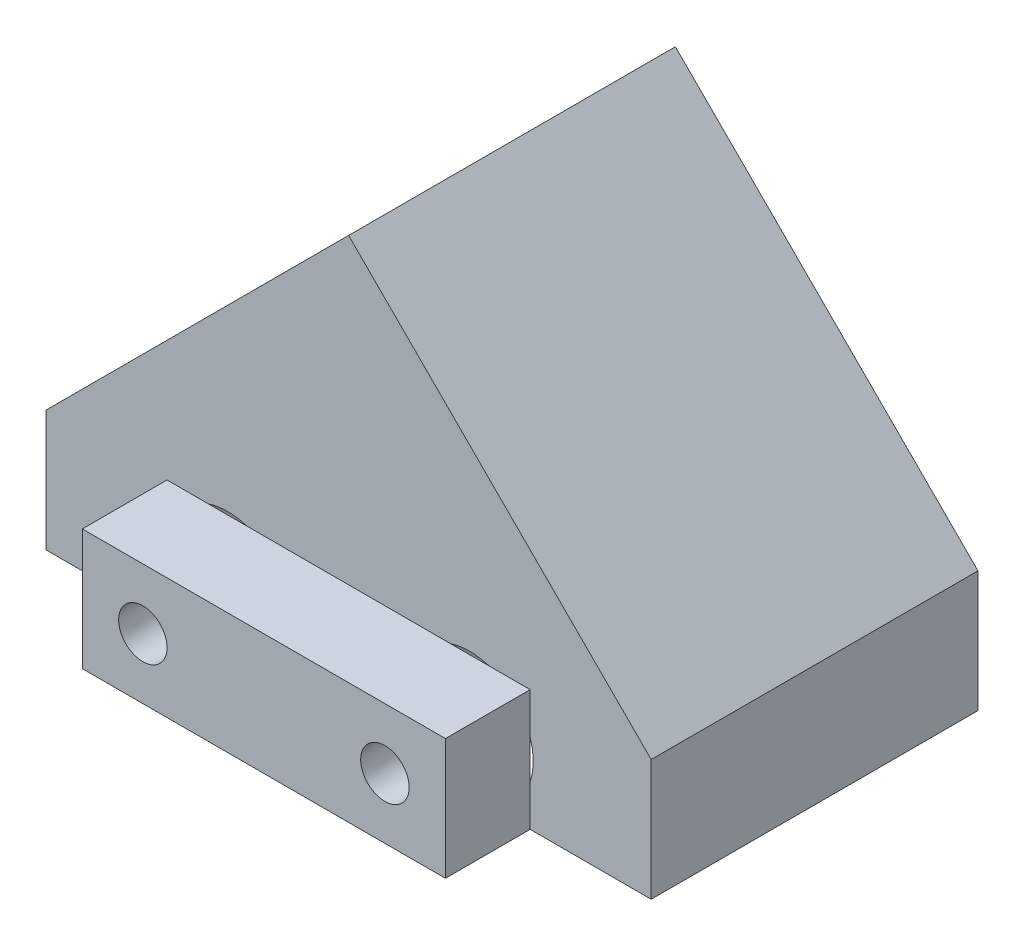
SolidWorks part; units mm, degrees
ref_plane "Plan de face" through (0, 0, 0) normal (0, 0, 1) x (1, 0, 0)
ref_plane "Plan de dessus" through (0, 0, 0) normal (0, 1, 0) x (1, 0, 0)
ref_plane "Plan de droite" through (0, 0, 0) normal (1, 0, 0) x (0, 0, -1)
sketch "Esquisse1" plane through (0, 0, 0) normal (0, 0, 1) x (1, 0, 0)
  line L1 (0, 0) -> (50, 0)
  line L2 (0, 0) -> (0, 35)
  line L3 (0, 35) -> (50, 35)
  line L4 (50, 0) -> (50, 35)
  point P7 (0, 0)
  dimension "D1" = 50
  dimension "D2" = 35
extrude "Boss.-Extru.1" add sketch "Esquisse1" along normal blind 27
sketch "Esquisse2" plane through (0, 0, 0) normal (0, 0, -1) x (-1, 0, 0)
  line L0 (-25, 35) -> (-50, 10)
  line L1 (-50, 35) -> (0, 35) construction
  line L2 (-50, 0) -> (-50, 35) construction
  line L3 (-50, 10) -> (-50, 35)
  line L4 (-50, 35) -> (-25, 35)
  dimension "D1" = 25
extrude "Enlèv. mat.-Extru.1" cut sketch "Esquisse2" against normal blind 27
sketch "Esquisse3" plane through (0, 0, 0) normal (0, 0, -1) x (-1, 0, 0)
  line L0 (-25, 35) -> (0, 10)
  line L1 (0, 35) -> (0, 0) construction
  line L2 (0, 10) -> (0, 35)
  line L3 (0, 35) -> (-25, 35)
  dimension "D1" = 25
extrude "Enlèv. mat.-Extru.2" cut sketch "Esquisse3" against normal blind 27
sketch "Esquisse4" plane through (0, 0, 27) normal (0, 0, 1) x (1, 0, 0)
  line L0 (0, 0) -> (50, 0) construction
  line L1 (10, 0) -> (40, 0)
  line L2 (10, 0) -> (10, 10)
  line L3 (10, 10) -> (40, 10)
  line L4 (40, 0) -> (40, 10)
  line L5 (0, 10) -> (0, 0) construction
  line L6 (50, 0) -> (50, 10) construction
  circle A0 centre (15, 5) radius 2
  circle A1 centre (35, 5) radius 2
  point P14 (0, 0)
  point P16 (15.1991, 5)
  dimension "D4" = 4
  dimension "D5" = 4
  dimension "D1" = 10
  dimension "D2" = 10
  dimension "D3" = 10
  dimension "D6" = 5
  dimension "D7" = 5
  dimension "D8" = 20
  dimension "D9" = 5
extrude "Boss.-Extru.2" add sketch "Esquisse4" along normal blind 7
sketch "Esquisse5" plane through (0, 0, 27) normal (0, 0, 1) x (1, 0, 0)
  circle A0 centre (15, 5) radius 5.25
  circle A1 centre (35, 5) radius 5.25
  dimension "D1" = 10.5
  dimension "D2" = 10.5
extrude "Enlèv. mat.-Extru.3" cut sketch "Esquisse5" against normal blind 33
